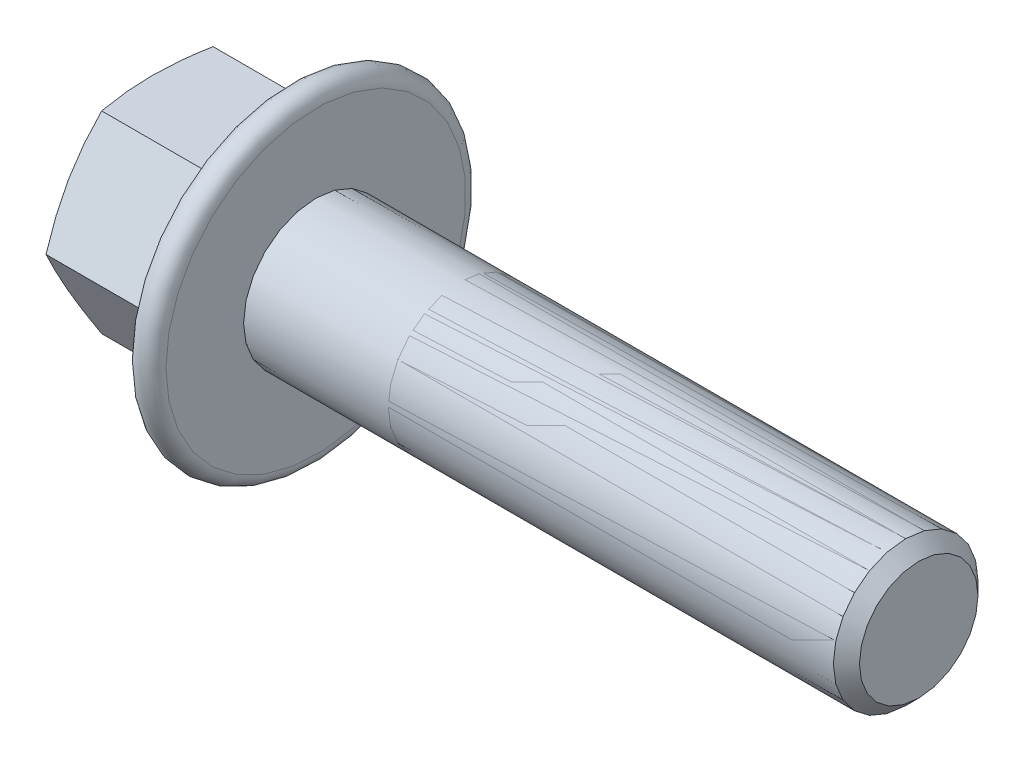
SolidWorks part; units mm, degrees
ref_plane "Front" through (0, 0, 0) normal (0, 0, 1) x (1, 0, 0)
ref_plane "Top" through (0, 0, 0) normal (0, 1, 0) x (1, 0, 0)
ref_plane "Right" through (0, 0, 0) normal (1, 0, 0) x (0, 0, -1)
sketch "Sketch1" plane through (0, 0, 0) normal (1, 0, 0) x (0, 0, -1)
  line L1 (2.3094, -4) -> (4.6188, 0)
  line L2 (4.6188, 0) -> (2.3094, 4)
  line L3 (2.3094, 4) -> (-2.3094, 4)
  line L4 (-2.3094, 4) -> (-4.6188, 0)
  line L5 (-4.6188, 0) -> (-2.3094, -4)
  line L6 (-2.3094, -4) -> (2.3094, -4)
  circle A0 centre (0, 0) radius 4 construction
  dimension "s" = 8
extrude "BaseHead" add sketch "Sketch1" along normal blind 6.8
ref_plane "Plane1" through (12.8, 0, 0) normal (1, 0, 0) x (0, 0, -1)
sketch "Sketch2" plane through (6.8, 0, 0) normal (1, 0, 0) x (0, 0, -1)
  circle A0 centre (0, 0) radius 3
  dimension "d" = 6
extrude "BaseBody" add sketch "Sketch2" along normal blind 25
sketch "Sketch3" plane through (2.5556, 0, 2.0632) normal (0, 1, 0) x (0, 0, -1)
  line L0 (6.682, 2.5556) -> (6.682, 2.3303)
  line L2 (6.682, 2.3303) -> (6.0632, 2.5556)
  line L4 (6.0632, 2.5556) -> (6.682, 2.5556)
  line L5 (2.0632, 3.5448) -> (2.0632, 2.0587) construction
  dimension "D1" = 20
  dimension "da" = 8
revolve "HeadChamfer" cut sketch "Sketch3" angle 360 about L5
sketch "Sketch5" plane through (-3.1384, 0, 9.9384) normal (0, 1, 0) x (0, 0, -1)
  line L0 (9.9384, -9.9384) -> (9.9384, -13.5308) construction
  line L1 (14.5572, -9.9384) -> (12.2478, -9.9384) construction
  line L2 (9.9384, -9.9384) -> (16.1614, -9.9384)
  line L3 (16.4052, -8.8384) -> (9.9384, -5.8229)
  line L4 (9.9384, -5.8229) -> (9.9384, -9.9384)
  line L5 (9.9384, -34.9384) -> (9.9384, -9.9384) construction
  arc A0 (16.1614, -9.9384) -> (16.4052, -8.8384) centre (16.1614, -9.3614) ccw
  dimension "D3" = 25
  dimension "c" = 1.1
  dimension "dc" = 13.6
revolve "Revolve1" add sketch "Sketch5" angle 360 about L0
fillet "HeadFillet" [suppressed] radius 0.25
fillet "FlangeHexFillet" radius 0.4 6 edges at (4.6158, -1.0695, -4.0013) (4.6158, 2.9305, -2.9269) (4.6158, -2.9305, 2.9269) (4.6158, 1.0695, 4.0013)
chamfer "Chamfer1" distance 0.5415 angle 45 1 edges at (31.8, 0, -3)
sketch "Sketch6" plane through (0, 0, 0) normal (0, 0, 1) x (1, 0, 0)
  line L0 (30.717, 3.5415) -> (31.2585, 3.5415)
  line L1 (31.2585, 3.5415) -> (31.2585, 3)
  line L2 (31.2585, 3) -> (30.9877, 2.531)
  line L3 (30.9877, 2.531) -> (30.717, 3)
  line L4 (30.717, 3) -> (30.717, 3.5415)
  line L5 (31.2585, 3) -> (6.8, 3) construction
  dimension "D1" = 0.5415
revolve "Cut-Revolve10" [suppressed] cut sketch "Sketch6" angle 360
pattern_linear "LPattern10" [suppressed] count 29
equation "\"b@ThreadCosmetic1\" = \"l@BaseBody\" - \"lg@Plane1\""
equation "\"D1@Chamfer1\" = (  \"d@Sketch2\" - \"D2@ThreadCosmetic1\" )  / 2"
equation "\"D1@Sketch6\" = (  \"d@Sketch2\" - \"D2@ThreadCosmetic1\" )  / 2"
equation "\"pitch@LPattern10\" = 1.2 * \"D1@Sketch6\""
equation "\"D1@LPattern10\" = \"b@ThreadCosmetic1\" / \"pitch@LPattern10\""
